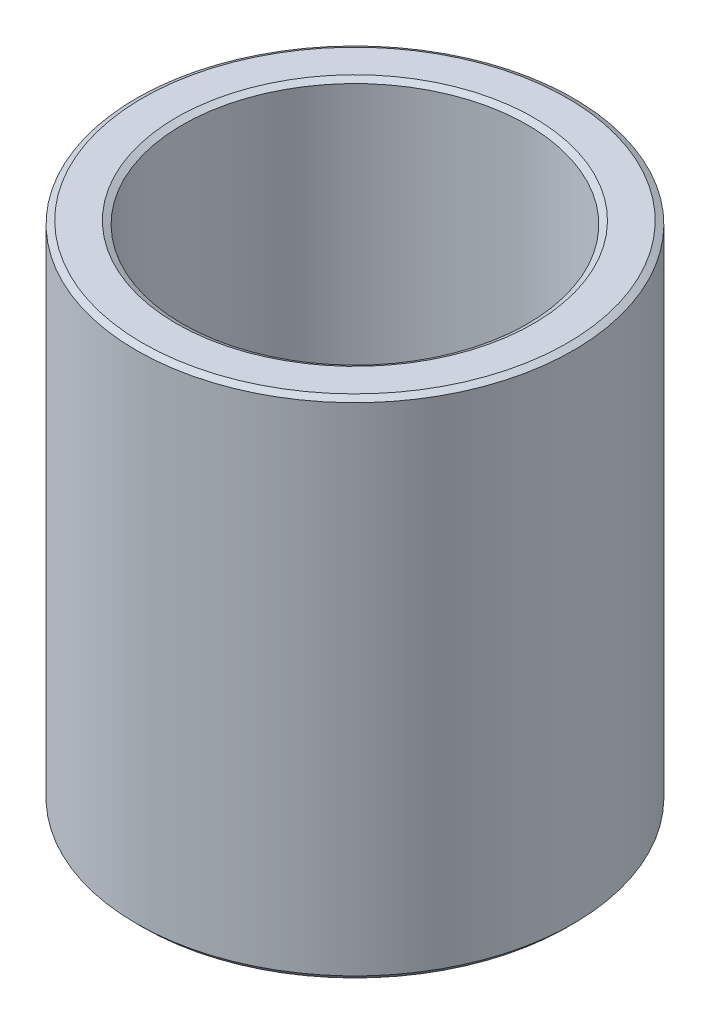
SolidWorks part; units mm, degrees
ref_plane "Front Plane" through (0, 0, 0) normal (0, 0, 1) x (1, 0, 0)
ref_plane "Top Plane" through (0, 0, 0) normal (0, 1, 0) x (1, 0, 0)
ref_plane "Right Plane" through (0, 0, 0) normal (1, 0, 0) x (0, 0, -1)
ref_plane "Plane1" through (0, 0, 0) normal (0, 0, -1) x (-1, 0, 0)
sketch "Sketch1" plane through (0, 0, 0) normal (0, 0, -1) x (-1, 0, 0)
  line L0 (-8.2667, 0) -> (-8, 0.2667)
  line L1 (-8, 0.2667) -> (-8, 21.8567)
  line L2 (-8, 21.8567) -> (-8.2667, 22)
  line L3 (-8.2667, 22) -> (-9.7333, 22)
  line L4 (-9.7333, 22) -> (-10, 21.8567)
  line L5 (-10, 21.8567) -> (-10, 0.2667)
  line L6 (-10, 0.2667) -> (-9.7333, 0)
  line L7 (-9.7333, 0) -> (-8.2667, 0)
  line L8 (-0.5, 0) -> (-0.5, 13.3333) construction
  dimension "D1" = 2
  dimension "D2" = 22
  dimension "D3" = 21.59
  dimension "D4" = 21.59
  dimension "D5" = 7.5
revolve "Revolve1" add sketch "Sketch1" angle 360 about L8
